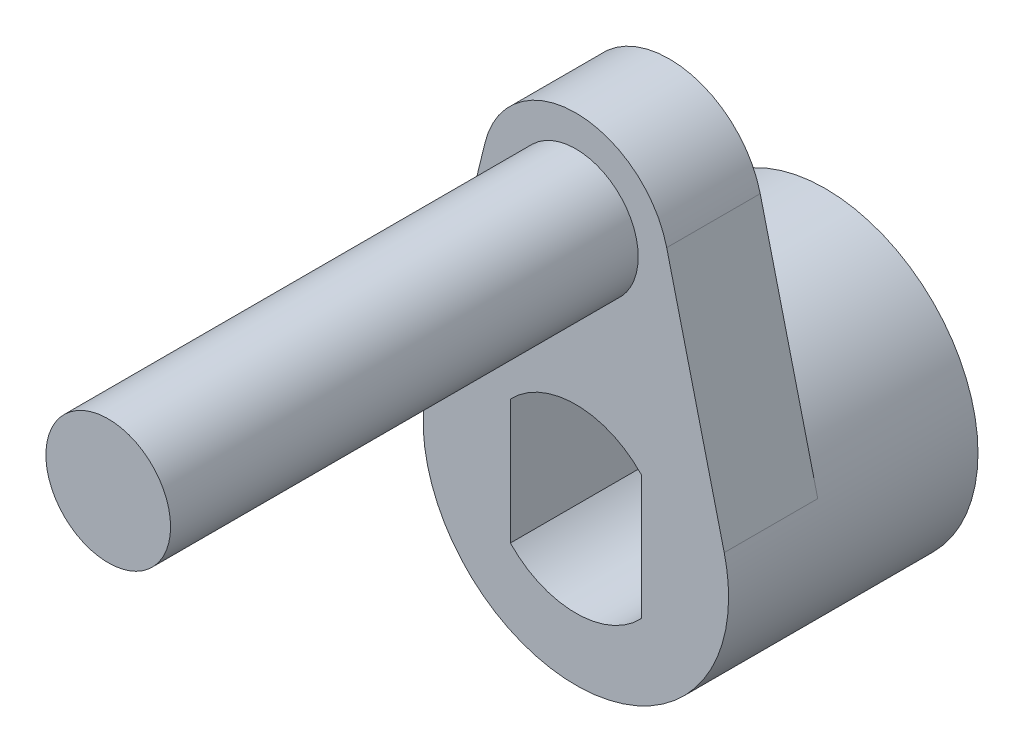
SolidWorks part; units mm, degrees
ref_plane "Plan de face" through (0, 0, 0) normal (0, 0, 1) x (1, 0, 0)
ref_plane "Plan de dessus" through (0, 0, 0) normal (0, 1, 0) x (1, 0, 0)
ref_plane "Plan de droite" through (0, 0, 0) normal (1, 0, 0) x (0, 0, -1)
sketch "Esquisse1" plane through (0, 0, 0) normal (0, 0, 1) x (1, 0, 0)
  line L4 (-23.7, -2) -> (-23.7, 2)
  line L5 (-27.9, 2) -> (-27.9, -2)
  line L6 (-23.7, -2) -> (-23.7, 2)
  line L7 (-27.9, 2) -> (-27.9, -2)
  circle A2 centre (-25.8, 0) radius 4.9
  arc A4 (-23.7, 2) -> (-27.9, 2) centre (-25.8, 0) ccw
  arc A5 (-27.9, -2) -> (-23.7, -2) centre (-25.8, 0) ccw
  arc A6 (-23.7, 2) -> (-27.9, 2) centre (-25.8, 0) ccw
  arc A7 (-27.9, -2) -> (-23.7, -2) centre (-25.8, 0) ccw
  dimension "D2" = 2
  dimension "D1" = 0.2
extrude "Boss.-Extru.1" add sketch "Esquisse1" against normal blind 8
sketch "Esquisse2" plane through (0, 0, 0) normal (0, 0, 1) x (1, 0, 0)
  line L0 (-25.8, 0) -> (-25.8, 8) construction
  line L1 (-21.0402, 1.1638) -> (-22.8858, 8.7125)
  line L2 (-30.5598, 1.1638) -> (-28.7142, 8.7125)
  line L3 (-27.9, 2) -> (-27.9, -2) construction
  line L4 (-23.7, -2) -> (-23.7, 2) construction
  line L5 (-27.9, 2) -> (-27.9, -2)
  line L6 (-23.7, -2) -> (-23.7, 2)
  arc A0 (-22.8858, 8.7125) -> (-28.7142, 8.7125) centre (-25.8, 8) ccw
  circle A1 centre (-25.8, 0) radius 4.9
  arc A2 (-30.5598, 1.1638) -> (-21.0402, 1.1638) centre (-25.8, 0) ccw
  arc A3 (-23.7, 2) -> (-27.9, 2) centre (-25.8, 0) ccw construction
  arc A4 (-27.9, -2) -> (-23.7, -2) centre (-25.8, 0) ccw construction
  arc A5 (-23.7, 2) -> (-27.9, 2) centre (-25.8, 0) ccw
  arc A6 (-27.9, -2) -> (-23.7, -2) centre (-25.8, 0) ccw
  dimension "D3" = 6
  dimension "D2" = 8
  dimension "D1" = 0
extrude "Boss.-Extru.2" add sketch "Esquisse2" against normal blind 3
sketch "Esquisse3" plane through (0, 0, 0) normal (0, 0, 1) x (1, 0, 0)
  line L0 (-25.8, 0) -> (-25.8, 10.5728) construction
  circle A0 centre (-25.8, 8) radius 2
  dimension "D2" = 4
  dimension "D1" = 8
extrude "Boss.-Extru.3" add sketch "Esquisse3" along normal blind 15
